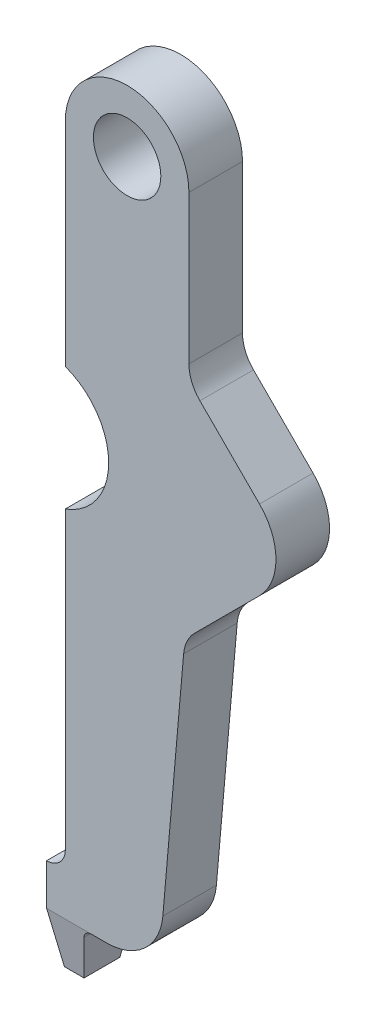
SolidWorks part; units mm, degrees
ref_plane "Front Plane" through (0, 0, 0) normal (0, 0, 1) x (1, 0, 0)
ref_plane "Top Plane" through (0, 0, 0) normal (0, 1, 0) x (1, 0, 0)
ref_plane "Right Plane" through (0, 0, 0) normal (1, 0, 0) x (0, 0, -1)
sketch "Sketch1" plane through (0, 0, 0) normal (0, 0, 1) x (1, 0, 0)
  line L0 (0, 0) -> (0, 44.069)
  line L1 (8.382, 44.069) -> (8.382, 32.9498)
  line L2 (8.1028, 17.7123) -> (15.8611, 25.4706)
  line L3 (15.8611, 25.4706) -> (8.382, 32.9498)
  line L4 (8.1028, 17.7123) -> (6.5532, 0)
  line L5 (6.5532, 0) -> (0, 0)
  line L6 (-11.7068, 44.069) -> (19.8228, 44.069) construction
  line L7 (4.191, 44.069) -> (4.191, 62.3822) construction
  line L8 (17.1955, 25.4706) -> (-26.9206, 25.4706) construction
  arc A0 (8.382, 44.069) -> (0, 44.069) centre (4.191, 44.069) ccw
  dimension "D3" = 4.191
  dimension "D1" = 48.26
  dimension "D2" = 17.78
  dimension "D4" = 8.382
  dimension "D5" = 6.5532
  dimension "D7" = 45
  dimension "D8" = 15.24
  dimension "D9" = 85
extrude "Extrude1" add sketch "Sketch1" along normal mid plane 3.6322
fillet "Fillet1" radius 3.81 1 edges at (15.8611, 25.4706, 0)
fillet "Fillet2" radius 2.54 2 edges at (8.1028, 17.7123, 0) (8.382, 32.9498, 0)
sketch "Sketch2" plane through (0, 0, 0) normal (0, -1, 0) x (1, 0, 0)
  line L0 (0, -1.8161) -> (6.5532, -1.8161) construction
  line L1 (6.5532, 1.8161) -> (-1.27, 1.8161)
  line L2 (6.5532, 1.8161) -> (6.5532, -1.8161)
  line L3 (6.5532, -1.8161) -> (-1.27, -1.8161)
  line L4 (-1.27, 1.8161) -> (-1.27, -1.8161)
  line L5 (0, 1.8161) -> (0, -1.8161) construction
  dimension "D1" = 1.27
extrude "Extrude2" add sketch "Sketch2" along normal blind 2.794
sketch "Sketch3" plane through (0, -2.794, 0) normal (0, -1, 0) x (1, 0, 0)
  line L0 (-1.27, -1.8161) -> (6.5532, -1.8161) construction
  line L1 (-1.27, 1.8161) -> (1.27, 1.8161)
  line L2 (-1.27, 1.8161) -> (-1.27, -1.8161)
  line L3 (-1.27, -1.8161) -> (1.27, -1.8161)
  line L4 (1.27, 1.8161) -> (1.27, -1.8161)
  dimension "D1" = 2.54
extrude "Extrude3" add sketch "Sketch3" along normal blind 3.429 draft 10
fillet "Fillet3" radius 3.81 1 edges at (6.5532, -2.794, 0)
fillet "Fillet4" radius 0.635 1 edges
fillet "Fillet5" radius 1.27 1 edges
sketch "Sketch4" plane through (0, 0, 1.8161) normal (0, 0, 1) x (1, 0, 0)
  circle A0 centre (4.191, 44.069) radius 2.286
  dimension "D1" = 4.572
extrude "Cut-Extrude1" cut sketch "Sketch4" against normal through all
sketch "Sketch5" plane through (0, 0, 0) normal (0, 0, 1) x (1, 0, 0)
  line L0 (14.283, 25.4706) -> (-18.8764, 25.4706) construction
  arc A0 (13.1671, 22.7766) -> (13.1671, 28.1647) centre (10.473, 25.4706) ccw construction
  circle A1 centre (-1.5046, 25.4706) radius 4.445
  dimension "D1" = 8.89
extrude "Cut-Extrude2" cut sketch "Sketch5" against normal through all and the other way through all
